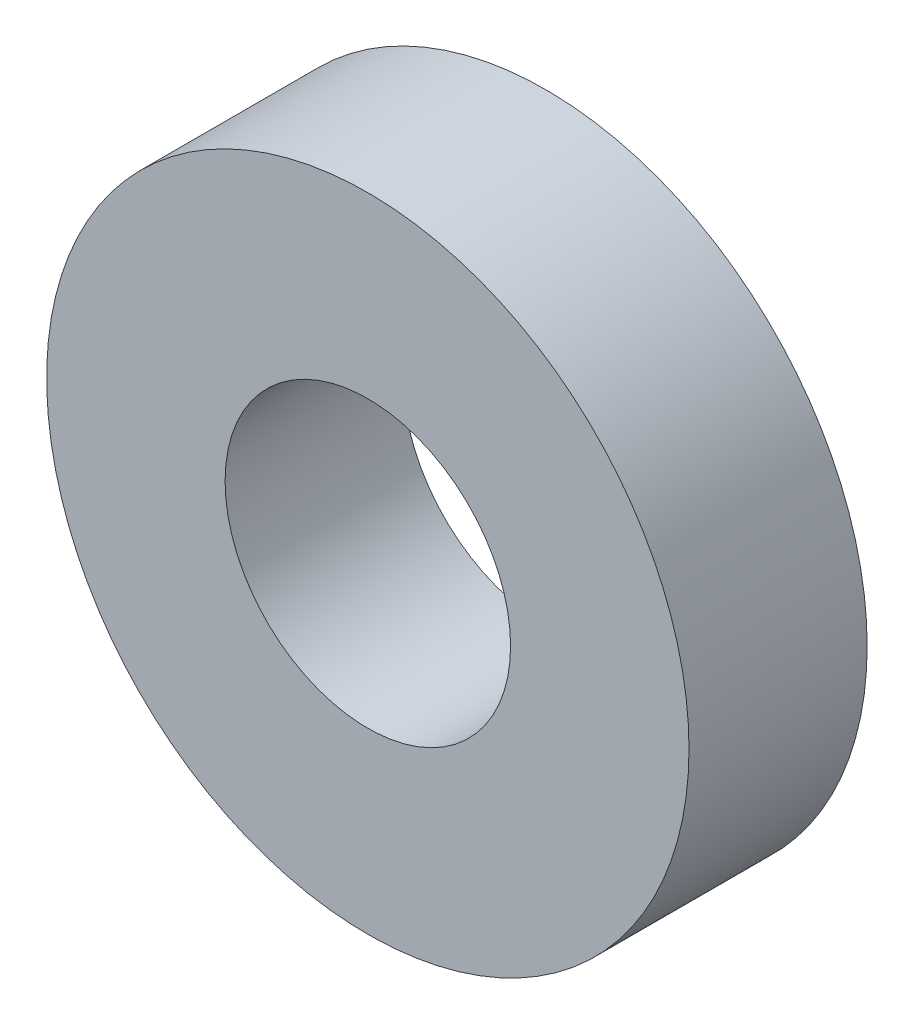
SolidWorks part; units mm, degrees
ref_plane "Front Plane" through (0, 0, 0) normal (0, 0, 1) x (1, 0, 0)
ref_plane "Top Plane" through (0, 0, 0) normal (0, 1, 0) x (1, 0, 0)
ref_plane "Right Plane" through (0, 0, 0) normal (1, 0, 0) x (0, 0, -1)
sketch "Sketch1" plane through (0, 0, 0) normal (0, 0, 1) x (1, 0, 0)
  circle A0 centre (0, 0) radius 6.35
  circle A1 centre (0, 0) radius 14.2875
  dimension "D1" = 12.7
  dimension "D2" = 28.575
extrude "Boss-Extrude1" add sketch "Sketch1" along normal blind 7.9248
